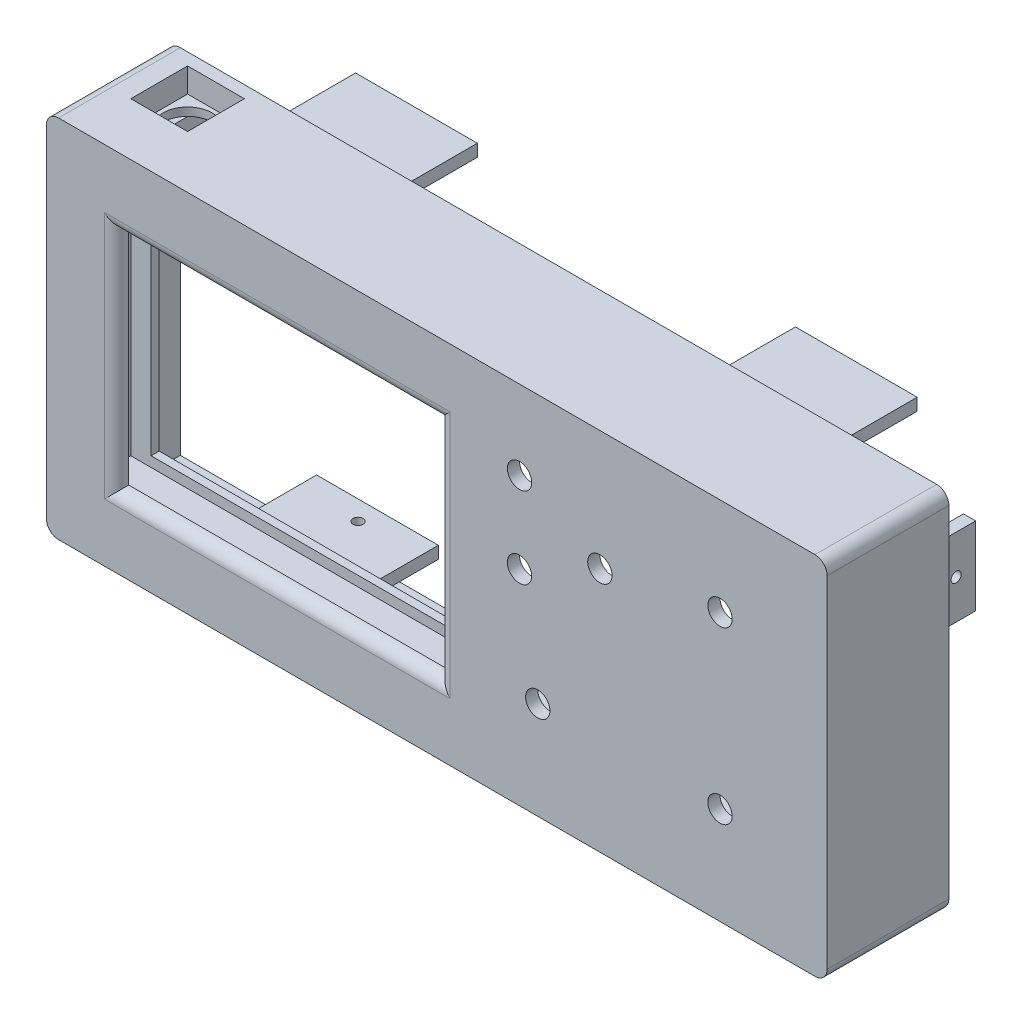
SolidWorks part; units mm, degrees
ref_plane "Front Plane" through (0, 0, 0) normal (0, 0, 1) x (1, 0, 0)
ref_plane "Top Plane" through (0, 0, 0) normal (0, 1, 0) x (1, 0, 0)
ref_plane "Right Plane" through (0, 0, 0) normal (1, 0, 0) x (0, 0, -1)
sketch "Sketch1" plane through (0, 0, 0) normal (0, 0, 1) x (1, 0, 0)
  line L1 (0, 0) -> (192.4, 0)
  line L2 (0, 0) -> (0, 90)
  line L3 (0, 90) -> (192.4, 90)
  line L4 (192.4, 0) -> (192.4, 90)
  dimension "D1" = 90
  dimension "D2" = 192.4
extrude "Boss-Extrude2" add sketch "Sketch1" against normal blind 30
sketch "Sketch3" plane through (0, 0, -30) normal (0, 0, -1) x (-1, 0, 0)
  line L0 (-192.4, 0) -> (-192.4, 90) construction
  line L1 (-189.4, 87) -> (-3, 87)
  line L2 (-189.4, 87) -> (-189.4, 3)
  line L3 (-189.4, 3) -> (-3, 3)
  line L4 (-3, 87) -> (-3, 3)
  line L5 (-192.4, 90) -> (0, 90) construction
  line L6 (0, 90) -> (0, 0) construction
  line L7 (0, 0) -> (-192.4, 0) construction
  point P7 (-192.4, 45)
  dimension "D1" = 3
  dimension "D2" = 3
  dimension "D3" = 3
  dimension "D4" = 3
extrude "Cut-Extrude1" cut sketch "Sketch3" against normal blind 27
sketch "Sketch4" plane through (0, 0, 0) normal (0, 0, 1) x (1, 0, 0)
  line L0 (0, 0) -> (192.4, 0) construction
  line L1 (17.3, 72.5) -> (96.5, 72.5)
  line L2 (17.3, 72.5) -> (17.3, 17.3)
  line L3 (17.3, 17.3) -> (96.5, 17.3)
  line L4 (96.5, 72.5) -> (96.5, 17.3)
  line L5 (0, 90) -> (0, 0) construction
  dimension "D1" = 55.2
  dimension "D2" = 79.2
  dimension "D3" = 17.3
  dimension "D4" = 17.3
extrude "Cut-Extrude2" cut sketch "Sketch4" against normal up to surface (3 mm away)
fillet "Fillet2" radius 3 4 edges at (56.9, 17.3, 0) (96.5, 44.9, 0) (56.9, 72.5, 0) (17.3, 44.9, 0)
fillet "Fillet3" radius 3 4 edges at (0, 0, -15) (192.4, 0, -15) (192.4, 90, -15) (0, 90, -15)
sketch "Potentiometer holes" plane through (0, 0, 0) normal (0, 0, 1) x (1, 0, 0)
  line L0 (189.4, 90) -> (3, 90) construction
  line L1 (99.5, 75.5) -> (99.5, 14.3) construction
  line L2 (3, 0) -> (189.4, 0) construction
  line L3 (192.4, 3) -> (192.4, 87) construction
  circle A0 centre (116.6, 70.5) radius 3
  circle A1 centre (116.6, 50.5) radius 3
  circle A3 centre (121.1, 24) radius 3
  circle A4 centre (136.4, 60.5) radius 3
  circle A5 centre (166, 66) radius 3
  circle A6 centre (166, 24) radius 3
  dimension "D2" = 6
  dimension "D5" = 6
  dimension "D7" = 6
  dimension "D9" = 6
  dimension "D12" = 6
  dimension "D15" = 6
  dimension "D1" = 19.5
  dimension "D3" = 17.1
  dimension "D4" = 20
  dimension "D6" = 21.6
  dimension "D8" = 24
  dimension "D10" = 19.8
  dimension "D11" = 29.5
  dimension "D13" = 24
  dimension "D14" = 24
  dimension "D16" = 26.4
sketch "Sketch7" plane through (0, 0, -3) normal (0, 0, -1) x (-1, 0, 0)
  line L0 (-3, 87) -> (-189.4, 87) construction
  line L1 (-165.4, 87) -> (-135.4, 87)
  line L2 (-165.4, 87) -> (-165.4, 84)
  line L3 (-165.4, 84) -> (-135.4, 84)
  line L4 (-135.4, 87) -> (-135.4, 84)
  line L5 (-96.2, 90) -> (-96.2, 0) construction
  line L14 (-189.4, 90) -> (-3, 90) construction
  line L17 (-3, 0) -> (-189.4, 0) construction
  line L18 (-192.4, 3) -> (-192.4, 87) construction
  line L19 (-27, 87) -> (-57, 87)
  line L20 (-57, 87) -> (-57, 84)
  line L21 (-27, 84) -> (-57, 84)
  line L22 (-27, 87) -> (-27, 84)
  line L25 (-189.4, 87) -> (-189.4, 3) construction
  dimension "D1" = 96.2
  dimension "D2" = 30
  dimension "D3" = 3
  dimension "D4" = 24
extrude "Boss-Extrude5" add sketch "Sketch7" along normal blind 46.2
sketch "Sketch9" plane through (0, 0, -3) normal (0, 0, -1) x (-1, 0, 0)
  line L0 (-189.4, 3) -> (-3, 3) construction
  line L1 (-165.4, 3) -> (-135.4, 3)
  line L2 (-165.4, 3) -> (-165.4, 6)
  line L3 (-165.4, 6) -> (-135.4, 6)
  line L4 (-135.4, 3) -> (-135.4, 6)
  line L5 (-189.4, 87) -> (-189.4, 3) construction
  line L6 (-96.2, 90) -> (-96.2, 0) construction
  line L7 (-189.4, 90) -> (-3, 90) construction
  line L8 (-3, 0) -> (-189.4, 0) construction
  line L9 (-192.4, 3) -> (-192.4, 87) construction
  line L10 (-27, 3) -> (-27, 6)
  line L11 (-27, 3) -> (-57, 3)
  line L12 (-57, 3) -> (-57, 6)
  line L13 (-27, 6) -> (-57, 6)
  dimension "D1" = 24
  dimension "D2" = 3
  dimension "D3" = 30
  dimension "D4" = 96.2
extrude "Boss-Extrude6" add sketch "Sketch9" along normal blind 36.6
sketch "Sketch10" plane through (0, 0, -3) normal (0, 0, -1) x (-1, 0, 0)
  line L1 (-192.4, 3) -> (-192.4, 87) construction
  line L3 (-189.4, 90) -> (-3, 90) construction
  line L4 (-96.2, 90) -> (-96.2, 0) construction
  line L5 (-3, 0) -> (-189.4, 0) construction
  line L6 (-189.4, 87) -> (-189.4, 3) construction
  line L7 (-189.4, 77.4) -> (-186.4, 77.4)
  line L8 (-189.4, 77.4) -> (-189.4, 58.2)
  line L9 (-189.4, 58.2) -> (-186.4, 58.2)
  line L10 (-186.4, 77.4) -> (-186.4, 58.2)
  line L11 (-165.4, 87) -> (-189.4, 87) construction
  line L20 (-3, 77.4) -> (-6, 77.4)
  line L21 (-3, 77.4) -> (-3, 58.2)
  line L22 (-3, 58.2) -> (-6, 58.2)
  line L23 (-6, 77.4) -> (-6, 58.2)
  dimension "D2" = 96.2
  dimension "D3" = 3
  dimension "D4" = 9.6
  dimension "D5" = 19.2
extrude "Boss-Extrude8" add sketch "Sketch10" along normal blind 36.6
sketch "Sketch13" plane through (189.4, 0, 0) normal (1, 0, 0) x (0, 0, -1)
  line L0 (39.6, 77.4) -> (30, 77.4) construction
  line L1 (30, 77.4) -> (30, 58.2) construction
  circle A0 centre (34.8, 67.8) radius 1.25
  dimension "D1" = 2.5
  dimension "D2" = 9.6
  dimension "D3" = 4.8
sketch "Sketch14" plane through (3, 0, 0) normal (-1, 0, 0) x (0, 0, 1)
  line L0 (-39.6, 77.4) -> (-30, 77.4) construction
  line L1 (-30, 58.2) -> (-30, 77.4) construction
  circle A0 centre (-34.8, 67.8) radius 1.25
  dimension "D3" = 2.5
  dimension "D1" = 9.6
  dimension "D2" = 4.8
sketch "Sketch15" plane through (0, 6, 0) normal (0, 1, 0) x (1, 0, 0)
  line L0 (135.4, 39.6) -> (165.4, 39.6) construction
  line L1 (165.4, 39.6) -> (165.4, 3) construction
  line L2 (96.2, 0) -> (96.2, 30) construction
  line L3 (3, 0) -> (189.4, 0) construction
  line L4 (3, 30) -> (189.4, 30) construction
  line L5 (0, 30) -> (0, 0) construction
  circle A0 centre (150.4, 34.8) radius 1.25
  circle A1 centre (42, 34.8) radius 1.25
  dimension "D3" = 2.5
  dimension "D1" = 4.8
  dimension "D2" = 15
  dimension "D4" = 96.2
extrude "Cut-Extrude3" cut sketch "Potentiometer holes" against normal up to surface (3 mm away)
extrude "Cut-Extrude5" cut sketch "Sketch15" against normal up to surface (3 mm away)
extrude "Cut-Extrude6" cut sketch "Sketch13" against normal up to surface (3 mm away)
extrude "Cut-Extrude7" cut sketch "Sketch14" against normal up to surface (3 mm away)
sketch "Sketch16" plane through (0, 0, -3) normal (0, 0, -1) x (-1, 0, 0)
  line L0 (-17.3, 17.3) -> (-96.5, 17.3) construction
  line L1 (-100.1, 16.3) -> (-8.3, 16.3)
  line L2 (-100.1, 16.3) -> (-100.1, 13.3)
  line L3 (-100.1, 13.3) -> (-8.3, 13.3)
  line L4 (-8.3, 16.3) -> (-8.3, 13.3)
  line L5 (-96.5, 17.3) -> (-96.5, 72.5) construction
  line L6 (-17.3, 72.5) -> (-17.3, 17.3) construction
  line L9 (-10.3, 13.3) -> (-8.3, 13.3)
  line L10 (-10.3, 74.3) -> (-8.3, 74.3)
  line L11 (-10.3, 74.3) -> (-10.3, 13.3)
  line L12 (-10.3, 13.3) -> (-8.3, 13.3)
  line L13 (-8.3, 74.3) -> (-8.3, 13.3)
  point P14 (-8.3, 14.8)
  dimension "D1" = 1
  dimension "D2" = 3
  dimension "D4" = 3.6
  dimension "D5" = 7
  dimension "D6" = 2
  dimension "D7" = 61
extrude "Boss-Extrude9" add sketch "Sketch16" along normal blind 9.5 contours L11 L1 L2 L3
sketch "Sketch18" plane through (0, 16.3, 0) normal (0, 1, 0) x (1, 0, 0)
  line L0 (10.3, 12.5) -> (10.3, 3) construction
  line L1 (100.1, 12.5) -> (10.3, 12.5)
  line L2 (100.1, 12.5) -> (100.1, 10.5)
  line L3 (100.1, 10.5) -> (10.3, 10.5)
  line L4 (10.3, 12.5) -> (10.3, 10.5)
  dimension "D1" = 2
extrude "Boss-Extrude10" add sketch "Sketch18" along normal blind 2.5
sketch "Sketch19" plane through (10.3, 0, 0) normal (1, 0, 0) x (0, 0, -1)
  line L1 (12.5, 74.3) -> (10.5, 74.3)
  line L2 (12.5, 74.3) -> (12.5, 18.8)
  line L3 (12.5, 18.8) -> (10.5, 18.8)
  line L4 (10.5, 74.3) -> (10.5, 18.8)
extrude "Boss-Extrude12" add sketch "Sketch19" along normal blind 5
sketch "Sketch21" plane through (0, 0, -3) normal (0, 0, -1) x (-1, 0, 0)
  line L1 (-100.1, 76.3) -> (-8.3, 76.3)
  line L2 (-100.1, 76.3) -> (-100.1, 74.3)
  line L3 (-100.1, 74.3) -> (-8.3, 74.3)
  line L4 (-8.3, 76.3) -> (-8.3, 74.3)
  line L6 (-100.1, 16.3) -> (-100.1, 13.3) construction
  dimension "D1" = 2
extrude "Boss-Extrude13" add sketch "Sketch21" along normal blind 9.5
sketch "Sketch22" plane through (0, 74.3, 0) normal (0, -1, 0) x (1, 0, 0)
  line L1 (100.1, -12.5) -> (15.3, -12.5)
  line L2 (100.1, -12.5) -> (100.1, -10.5)
  line L3 (100.1, -10.5) -> (15.3, -10.5)
  line L4 (15.3, -12.5) -> (15.3, -10.5)
extrude "Boss-Extrude14" add sketch "Sketch22" along normal blind 2
sketch "Sketch23" plane through (0, 90, 0) normal (0, 1, 0) x (1, 0, 0)
  line L0 (189.4, 0) -> (3, 0) construction
  line L1 (21.8, 13) -> (7.8, 13)
  line L2 (21.8, 13) -> (21.8, 27)
  line L3 (21.8, 27) -> (7.8, 27)
  line L4 (7.8, 13) -> (7.8, 27)
  line L5 (3, 30) -> (3, 0) construction
  line L7 (23.24, 11.56) -> (6.36, 11.56)
  line L8 (23.24, 11.56) -> (23.24, 28.44)
  line L9 (23.24, 28.44) -> (6.36, 28.44)
  line L10 (6.36, 11.56) -> (6.36, 28.44)
  point P12 (14.8, 27)
  dimension "D1" = 13
  dimension "D2" = 4.8
  dimension "D3" = 14
  dimension "D4" = 14
  dimension "D5" = 1.44
  dimension "D6" = 1.44
  dimension "D7" = 1.44
  dimension "D8" = 1.44
extrude "Boss-Extrude15" add sketch "Sketch23" against normal blind 8 contours L4 L1 L2 L3 | L10 L7 L8 L9 L1 L4 L3 L2
sketch "Sketch24" plane through (0, 90, 0) normal (0, 1, 0) x (1, 0, 0)
  line L0 (3, 30) -> (3, 0) construction
  line L1 (21.8, 13) -> (7.8, 13)
  line L2 (21.8, 13) -> (21.8, 27)
  line L3 (21.8, 27) -> (7.8, 27)
  line L4 (7.8, 13) -> (7.8, 27)
  line L5 (189.4, 0) -> (3, 0) construction
  dimension "D1" = 14
  dimension "D2" = 14
  dimension "D3" = 4.8
  dimension "D4" = 13
extrude "Cut-Extrude8" cut sketch "Sketch24" against normal blind 6
sketch "Sketch25" plane through (0, 84, 0) normal (0, 1, 0) x (1, 0, 0)
  line L0 (21.8, 27) -> (7.8, 27) construction
  line L1 (21.8, 13) -> (21.8, 27) construction
  circle A0 centre (14.8, 20) radius 6
  dimension "D3" = 12
  dimension "D1" = 7
  dimension "D2" = 7
extrude "Cut-Extrude9" cut sketch "Sketch25" against normal up to surface (2 mm away)
